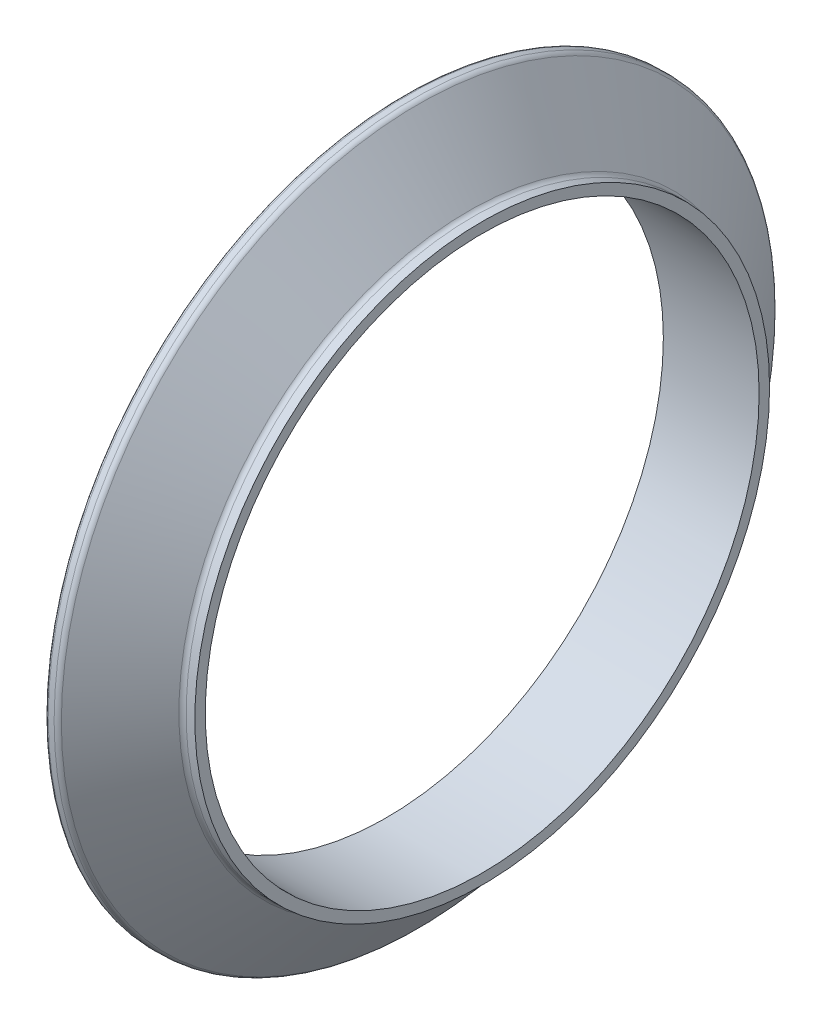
SolidWorks part; units mm, degrees
ref_plane "Front Plane" through (0, 0, 0) normal (0, 0, 1) x (1, 0, 0)
ref_plane "Top Plane" through (0, 0, 0) normal (0, 1, 0) x (1, 0, 0)
ref_plane "Right Plane" through (0, 0, 0) normal (1, 0, 0) x (0, 0, -1)
sketch "Sketch1" plane through (0, 0, 0) normal (0, 0, 1) x (1, 0, 0)
  line L0 (0, 0) -> (-37.0343, 0) construction
  line L1 (0, 73.4314) -> (-25.4, 73.4314)
  line L2 (-25.4, 73.4314) -> (-25.4, 85.9536)
  line L3 (-24.5872, 86.7664) -> (-21.4503, 86.7664)
  line L4 (-20.6375, 87.5792) -> (-20.6375, 94.4372)
  line L5 (-19.8247, 95.25) -> (-18.2603, 95.25)
  line L6 (-16.9824, 94.6128) -> (-3.5874, 76.8372)
  line L7 (-2.3095, 76.2) -> (0, 76.2)
  line L8 (0, 76.2) -> (0, 73.4314)
  arc A0 (-19.8247, 95.25) -> (-20.6375, 94.4372) centre (-19.8247, 94.4372) ccw
  arc A1 (-20.6375, 87.5792) -> (-21.4503, 86.7664) centre (-21.4503, 87.5792) cw
  arc A2 (-24.5872, 86.7664) -> (-25.4, 85.9536) centre (-24.5872, 85.9536) ccw
  arc A3 (-2.3095, 76.2) -> (-3.5874, 76.8372) centre (-2.3095, 77.8002) cw
  arc A4 (-16.9824, 94.6128) -> (-18.2603, 95.25) centre (-18.2603, 93.6498) ccw
  point P13 (-20.6375, 95.25)
  point P18 (-25.4, 86.7664)
  point P23 (-17.4625, 95.25)
  dimension "D7" = 0.8128
  dimension "D8" = 1.6002
  dimension "D1" = 73.4314
  dimension "D2" = 76.2
  dimension "D3" = 95.25
  dimension "D4" = 86.7664
  dimension "D5" = 3.175
  dimension "D6" = 4.7625
  dimension "D9" = 25.4
  dimension "D10" = 25.4
revolve "Revolve1" add sketch "Sketch1" angle 360 about L0
